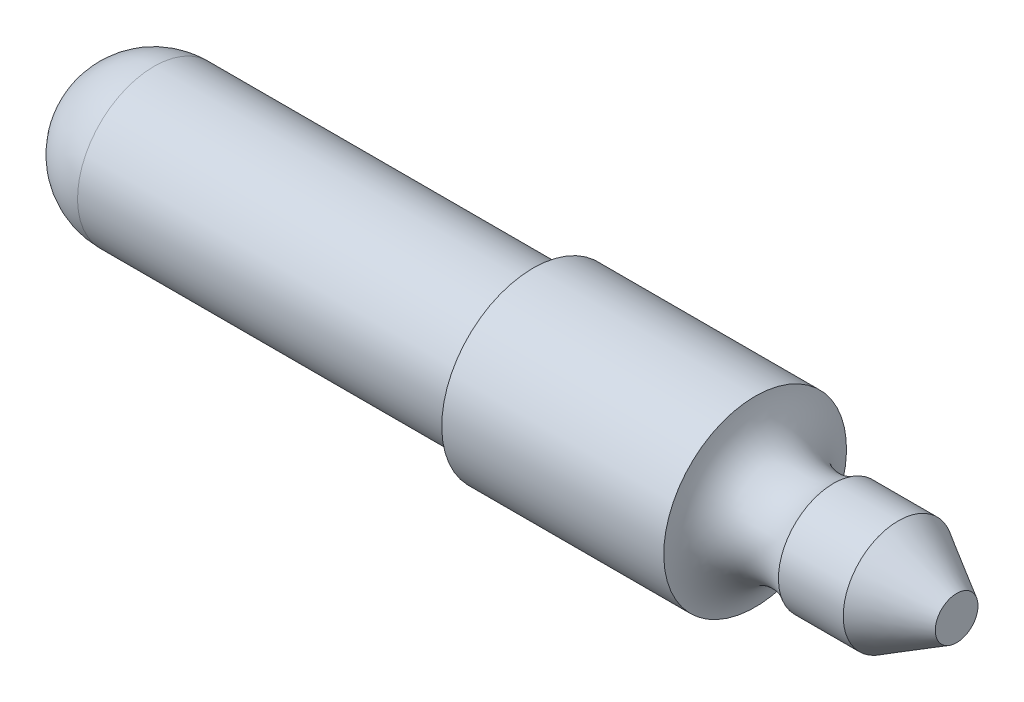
SolidWorks part; units mm, degrees
ref_plane "Front Plane" through (0, 0, 0) normal (0, 0, 1) x (1, 0, 0)
ref_plane "Top Plane" through (0, 0, 0) normal (0, 1, 0) x (1, 0, 0)
ref_plane "Right Plane" through (0, 0, 0) normal (1, 0, 0) x (0, 0, -1)
sketch "Sketch1" plane through (0, 0, 0) normal (0, 0, 1) x (1, 0, 0)
  line L0 (0, 0) -> (-11.938, 0)
  line L1 (-11.938, 0) -> (-11.938, 1.137) construction
  line L2 (-11.938, 1.137) -> (-6.299, 1.137)
  line L3 (-6.299, 1.137) -> (-6.299, 1.359)
  line L4 (-6.299, 1.359) -> (-2.997, 1.359)
  line L5 (0, 0) -> (0, 0.318)
  line L6 (0, 0.318) -> (-0.8678, 0.819)
  line L7 (-0.8678, 0.819) -> (-1.8314, 0.819)
  line L8 (-13.075, 0) -> (-11.938, 0)
  arc A0 (-2.997, 1.359) -> (-1.8314, 0.819) centre (-2.2419, 1.461) ccw
  arc A1 (-11.938, 1.137) -> (-13.075, 0) centre (-11.938, 0) ccw
  dimension "D10" = 1.524
  dimension "D1" = 11.938
  dimension "D2" = 1.137
  dimension "D3" = 1.359
  dimension "D4" = 5.639
  dimension "D5" = 3.302
  dimension "D6" = 0.318
  dimension "D7" = 30
  dimension "D8" = 0.819
  dimension "D9" = 1.461
revolve "Revolve1" add sketch "Sketch1" angle 360 about L0
